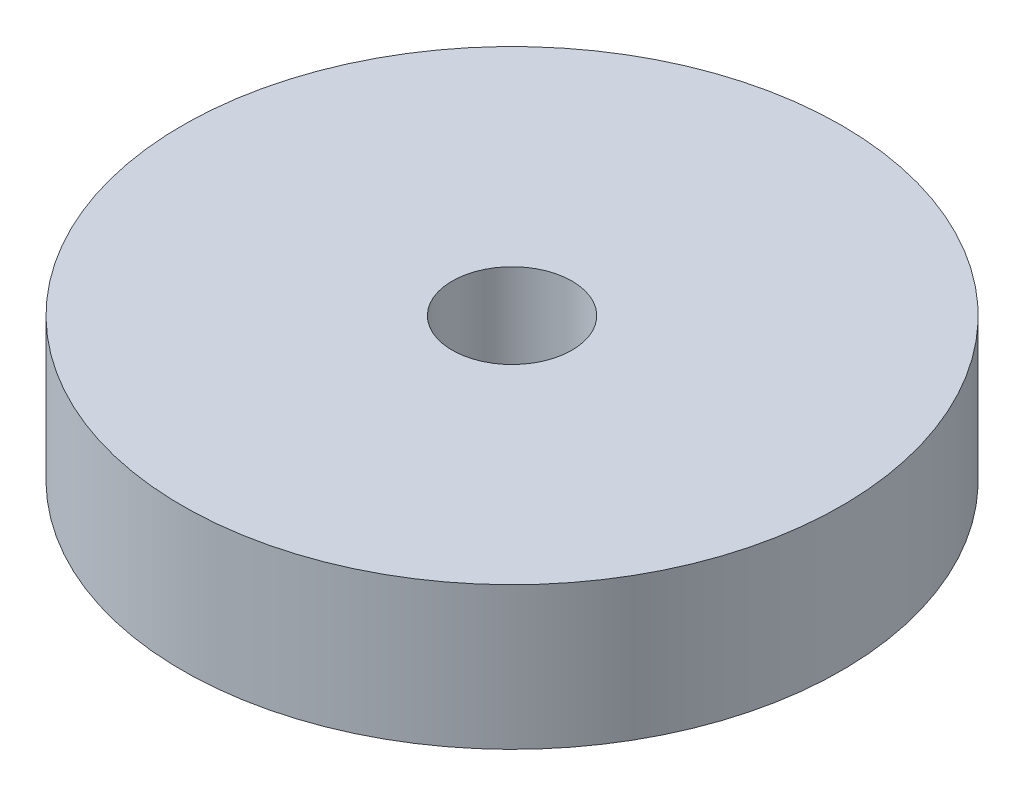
SolidWorks part; units mm, degrees
ref_plane "Plane1" through (0, 0, 0) normal (0, 0, 1) x (1, 0, 0)
ref_plane "Plane2" through (0, 0, 0) normal (0, 1, 0) x (1, 0, 0)
ref_plane "Plane3" through (0, 0, 0) normal (1, 0, 0) x (0, 0, -1)
sketch "Sketch1" plane through (0, 0, 0) normal (-1, 0, 0) x (0, 1, 0)
  line L0 (-3.175, 0) -> (6.35, 0) construction
  line L1 (0, 2.54) -> (0, 13.97)
  line L2 (0, 13.97) -> (-6.0452, 13.97)
  line L3 (-6.0452, 13.97) -> (-6.0452, 2.54)
  line L4 (-6.0452, 2.54) -> (0, 2.54)
  dimension "Thickness" = 6.0452
  dimension "Inside_dia" = 5.08
  dimension "Outside_dia" = 27.94
revolve "Base-Revolve" add sketch "Sketch1" angle 360 about L0
